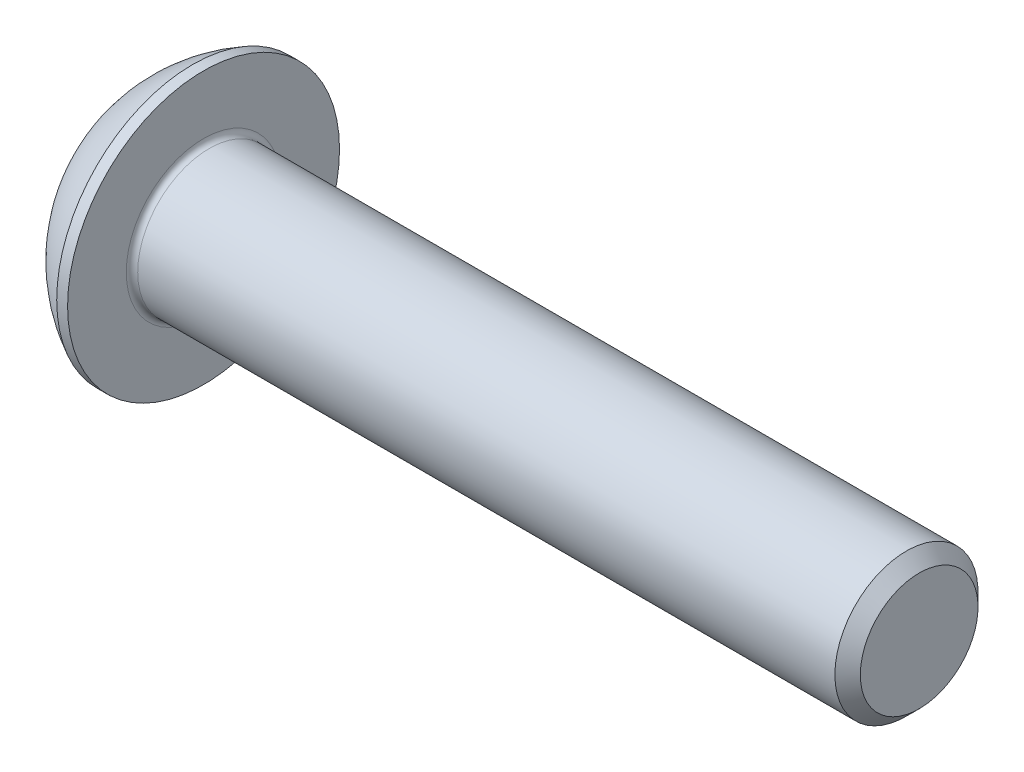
SolidWorks part; units mm, degrees
ref_plane "Plane1" through (0, 0, 0) normal (0, 0, 1) x (1, 0, 0)
ref_plane "Plane2" through (0, 0, 0) normal (0, 1, 0) x (1, 0, 0)
ref_plane "Plane3" through (0, 0, 0) normal (1, 0, 0) x (0, 0, -1)
sketch "BodySke" plane through (0, 0, 0) normal (0, 0, 1) x (1, 0, 0)
  line L0 (27.75, 0) -> (27.75, 2.055)
  line L1 (27.305, 2.5) -> (2.75, 2.5)
  line L2 (2.75, 2.5) -> (2.75, 4.75)
  line L3 (2.75, 4.75) -> (2.37, 4.75)
  line L4 (0, 0) -> (101.6, 0) construction
  line L5 (2.75, -4.75) -> (2.37, -4.75) construction
  line L6 (55.6768, -2.5) -> (2.75, -2.5) construction
  line L7 (27.75, 0) -> (0, 0)
  line L8 (0, 2.375) -> (0, -2.375) construction
  line L9 (0, 0) -> (0, 2.375)
  line L10 (27.75, 2.055) -> (27.305, 2.5)
  line L11 (27.75, -2.055) -> (27.305, -2.5) construction
  line L12 (3.55, 9.525) -> (3.55, -2.5) construction
  line L13 (2.75, 9.525) -> (2.75, -2.5) construction
  arc A1 (0, 2.375) -> (2.37, 4.75) centre (4.755, 0) cw
revolve "BaseBody" add sketch "BodySke" angle 360 about L4
fillet "Fillet1" radius 0.2 1 edges at (2.75, 0, 2.5)
sketch "Sketch2" plane through (0, 0, 0) normal (0, 0, 1) x (1, 0, 0)
  line L0 (0, 1.5) -> (1.56, 1.5)
  line L1 (1.56, 1.5) -> (2.426, 0)
  line L3 (2.426, 0) -> (0, 0)
  line L4 (0, 0) -> (0, 1.5)
  line L5 (0, -1.5) -> (1.56, -1.5) construction
  line L6 (0, 0) -> (47.625, 0) construction
  dimension "D2" = 60
  dimension "PreBroach_depth" = 1.56
  dimension "PreBroach_dia" = 3
revolve "PreBroach" cut sketch "Sketch2" angle 360 about L6
sketch "Sketch3" plane through (0, 0, 0) normal (1, 0, 0) x (0, 0, -1)
  line L0 (-1.5, -0.866) -> (-1.5, 0.866)
  line L1 (-1.5, 0.866) -> (0, 1.7321)
  line L2 (0, 1.7321) -> (1.5, 0.866)
  line L3 (1.5, 0.866) -> (1.5, -0.866)
  line L4 (1.5, -0.866) -> (0, -1.7321)
  line L5 (0, -1.7321) -> (-1.5, -0.866)
extrude "Hex" cut sketch "Sketch3" along normal blind 1.56
sketch "ThdSchSke" plane through (0, 0, 0) normal (0, 0, 1) x (1, 0, 0)
  line L0 (4.35, -2.055) -> (4.0384, -2.5)
  line L1 (4.35, -2.055) -> (4.6616, -2.5)
  line L2 (4.6616, -2.5) -> (4.6616, -3.125)
  line L3 (-3.175, 0) -> (5.1513, 0) construction
  line L5 (4.6616, -3.125) -> (4.0384, -3.125)
  line L6 (4.0384, -3.125) -> (4.0384, -2.5)
revolve "ThreadSchematic" [suppressed] cut sketch "ThdSchSke" angle 360 about L3
pattern_linear "ThdSchPat" [suppressed]
equation "\"D1@BodySke\" = \"Head_dia@BodySke\" * .5"
equation "\"Thread_minor@ThreadCosmetic\" = \"Minor_dia@BodySke\""
equation "\"D1@Sketch3\" = \"Hex_size@Sketch3\" / 2"
equation "\"D2@Sketch3\" = \"D1@Sketch3\""
equation "\"D3@Sketch3\" = \"Hex_size@Sketch3\""
equation "\"Thread_length@ThreadCosmetic\" = ((sgn( (\"Length@BodySke\" - \"Advance@BodySke\" * 2.0) - \"Thread_nom@BodySke\" )-1)*( (\"Length@BodySke\" - \"Advance@BodySke\" * 2.0) - \"Thread_nom@BodySke\" ))/-2+ \"Thread_no"
equation "\"Thread_minor@ThdSchSke\" = \"Minor_dia@BodySke\""
equation "\"Diameter@ThdSchSke\" = \"Diameter@BodySke\""
equation "\"Overcut@ThdSchSke\" = \"Diameter@BodySke\" * 1.25"
equation "\"Start@ThdSchSke\" = \"Head_ht@BodySke\" + \"Length@BodySke\" - \"Thread_length@ThreadCosmetic\"  '---Non-countersunk---"
equation "\"Num_threads@ThdSchPat\" = int( \"Thread_length@ThreadCosmetic\" / \"Advance@BodySke\" + 0.999 )  + 1"
equation "\"Advance@ThdSchPat\" = \"Thread_length@ThreadCosmetic\" /  (\"Num_threads@ThdSchPat\" - 1) 'relax it"
equation "\"Num_threads@ThdSchPat\" = \"Num_threads@ThdSchPat\" - sgn( \"Num_threads@ThdSchPat\" - 1) '---chamfered tips only---"
